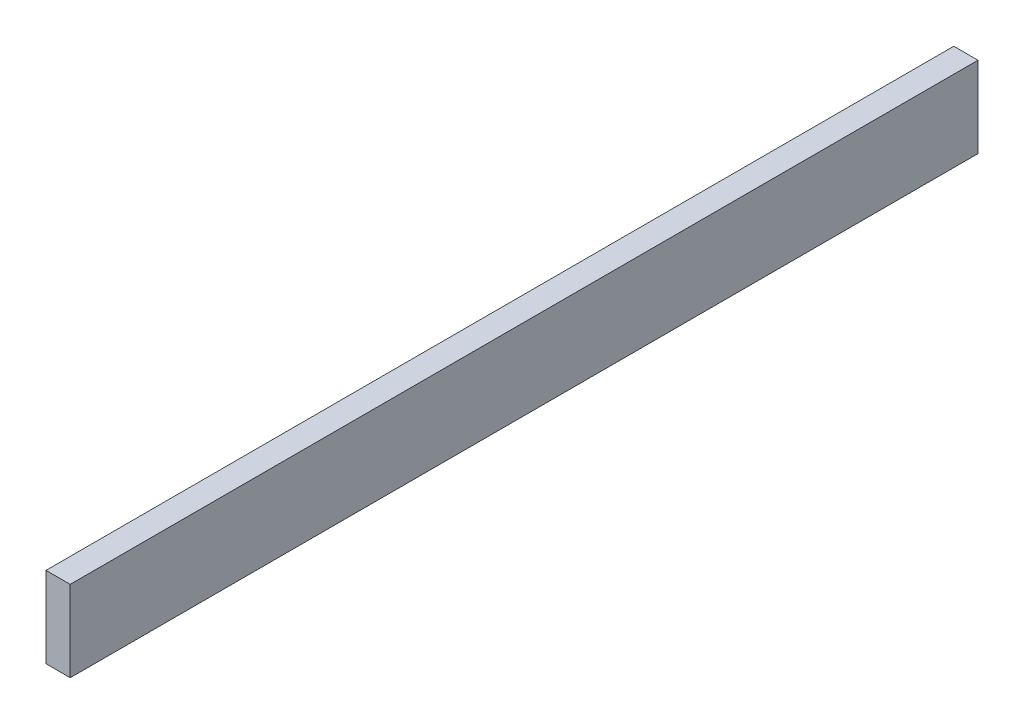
SolidWorks part; units mm, degrees
ref_plane "Front Plane" through (0, 0, 0) normal (0, 0, 1) x (1, 0, 0)
ref_plane "Top Plane" through (0, 0, 0) normal (0, 1, 0) x (1, 0, 0)
ref_plane "Right Plane" through (0, 0, 0) normal (1, 0, 0) x (0, 0, -1)
sketch "Sketch1" plane through (0, 0, 0) normal (1, 0, 0) x (0, 0, -1)
  line L1 (-217.3524, 64.8032) -> (232.6476, 64.8032)
  line L2 (-217.3524, 64.8032) -> (-217.3524, 24.7032)
  line L3 (-217.3524, 24.7032) -> (232.6476, 24.7032)
  line L4 (232.6476, 64.8032) -> (232.6476, 24.7032)
  dimension "D1" = 450
  dimension "D2" = 40.1
extrude "Boss-Extrude1" add sketch "Sketch1" along normal blind 12
